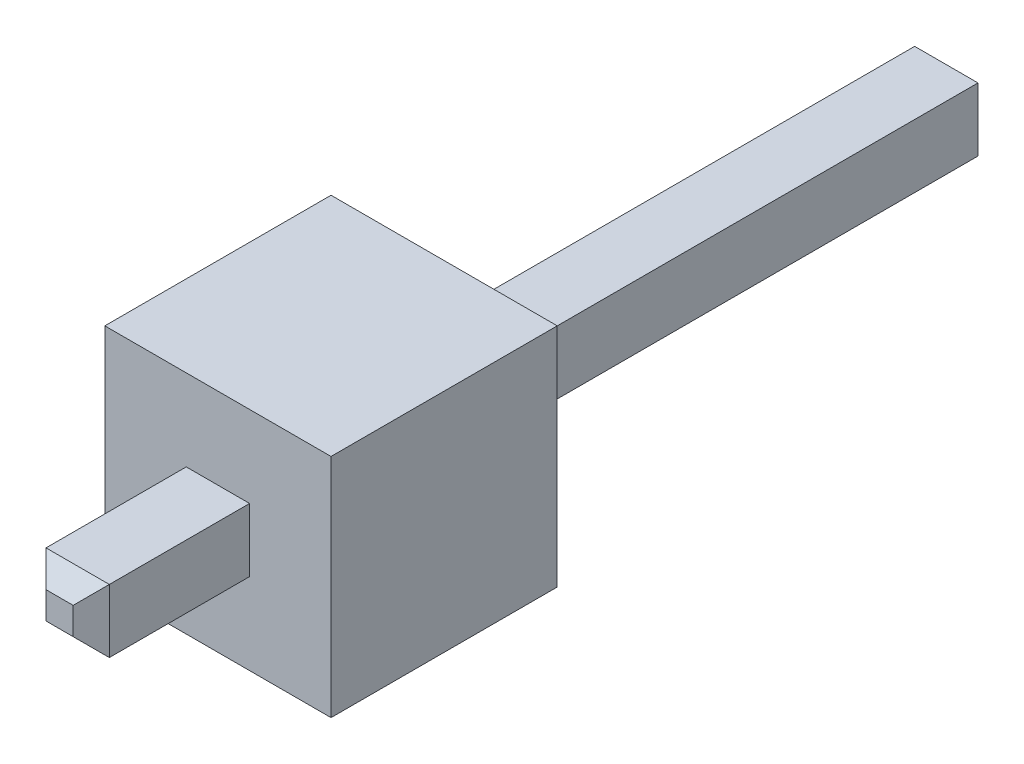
SolidWorks part; units mm, degrees
ref_plane "Front Plane" through (0, 0, 0) normal (0, 0, 1) x (1, 0, 0)
ref_plane "Top Plane" through (0, 0, 0) normal (0, 1, 0) x (1, 0, 0)
ref_plane "Right Plane" through (0, 0, 0) normal (1, 0, 0) x (0, 0, -1)
sketch "Sketch1" plane through (0, 0, 0) normal (0, 0, 1) x (1, 0, 0)
  line L1 (-0.3556, -0.3556) -> (0.3556, -0.3556)
  line L2 (-0.3556, -0.3556) -> (-0.3556, 0.3556)
  line L3 (-0.3556, 0.3556) -> (0.3556, 0.3556)
  line L4 (0.3556, -0.3556) -> (0.3556, 0.3556)
  line L5 (-0.3556, -0.3556) -> (0.3556, 0.3556) construction
  line L6 (-0.3556, 0.3556) -> (0.3556, -0.3556) construction
  point P0 (0, 0)
  dimension "D1" = 0.7112
  dimension "D2" = 0.7112
extrude "Boss-Extrude1" add sketch "Sketch1" along normal blind 10.16
sketch "Sketch3" plane through (0.3556, 0, 0) normal (1, 0, 0) x (0, 0, -1)
  line L0 (-10.16, -0.3556) -> (0, -0.3556) construction
  line L1 (-10.16, 0.3556) -> (-9.4488, 0.3556)
  line L2 (-10.16, 0.3556) -> (-10.16, -0.3556)
  line L3 (-10.16, -0.3556) -> (-9.4488, -0.3556)
  line L4 (-9.4488, 0.3556) -> (-9.4488, -0.3556)
  dimension "D1" = 0.7112
ref_plane "Plane1" [suppressed] through (-2.4384, 0, 0) normal (-1, 0, 0) x (0, 0, 1)
sketch "Sketch4" [suppressed] plane through (-2.4384, 0, 0) normal (-1, 0, 0) x (0, 0, 1)
  circle A0 centre (9.8044, 0) radius 0.6567
extrude "Boss-Extrude3" [suppressed] add sketch "Sketch4" along normal blind 0.0762 separate body
ref_plane "Plane2" through (0, 0, 5.842) normal (0, 0, -1) x (-1, 0, 0)
sketch "Sketch5" plane through (0, 0, 5.842) normal (0, 0, -1) x (-1, 0, 0)
  line L1 (1.27, -1.27) -> (-1.27, -1.27)
  line L2 (1.27, -1.27) -> (1.27, 1.27)
  line L3 (1.27, 1.27) -> (-1.27, 1.27)
  line L4 (-1.27, -1.27) -> (-1.27, 1.27)
  line L5 (1.27, -1.27) -> (-1.27, 1.27) construction
  line L6 (1.27, 1.27) -> (-1.27, -1.27) construction
  point P0 (0, 0)
  dimension "D1" = 2.54
  dimension "D2" = 2.54
extrude "Boss-Extrude4" add sketch "Sketch5" against normal blind 2.54
chamfer "Chamfer1" distance 0.2032 angle 45 8 edges at (-0.3556, 0, 10.16) (0, 0.3556, 10.16) (0.3556, 0, 10.16) (0, -0.3556, 10.16) (0, 0.3556, 0) (-0.3556, 0, 0) (0, -0.3556, 0) (0.3556, 0, 0)
sketch "Sketch6" plane through (0, 0, 8.382) normal (0, 0, 1) x (1, 0, 0)
  circle A0 centre (0, 0) radius 0.5931 construction
